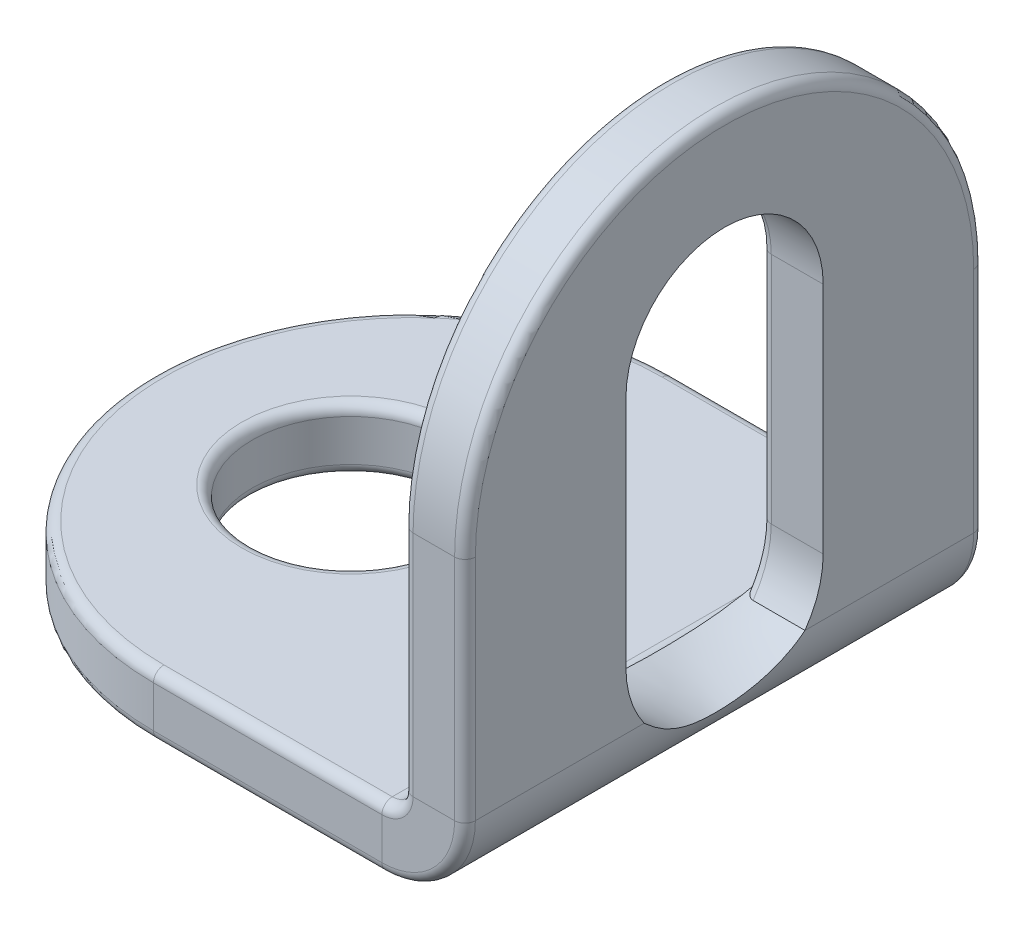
SolidWorks part; units mm, degrees
ref_plane "Front" through (0, 0, 0) normal (0, 0, 1) x (1, 0, 0)
ref_plane "Top" through (0, 0, 0) normal (0, 1, 0) x (1, 0, 0)
ref_plane "Right" through (0, 0, 0) normal (1, 0, 0) x (0, 0, -1)
sketch "Sketch1" plane through (0, 0, 0) normal (0, 1, 0) x (1, 0, 0)
  line L1 (0, 0) -> (15.24, 0)
  line L2 (11.049, 8.763) -> (16.764, 8.763)
  line L3 (0, 12.7) -> (15.24, 12.7)
  line L5 (11.049, 3.937) -> (16.764, 3.937)
  arc A0 (0, 12.7) -> (0, 0) centre (0, 6.35) ccw
  arc A1 (15.24, 0) -> (15.24, 12.7) centre (15.24, 6.35) ccw
  circle A2 centre (-1.524, 6.35) radius 2.413
  arc A3 (11.049, 8.763) -> (11.049, 3.937) centre (11.049, 6.35) ccw
  arc A4 (16.764, 3.937) -> (16.764, 8.763) centre (16.764, 6.35) ccw
  dimension "D3" = 4.826
  dimension "D1" = 12.7
  dimension "D2" = 15.24
  dimension "D4" = 1.524
  dimension "D5" = 4.826
  dimension "D6" = 2.413
  dimension "D7" = 1.524
  dimension "D8" = 5.715
sheet metal parameters "Sheet-Metal1" thickness 1.524 parameters "D1"=3.81
base flange "Base-Flange1" sketch "Sketch1" thickness 1.524 reverse thickness direction yes parameters "D1"=3.81
sketch "Sketch3" plane through (0, 1.524, 0) normal (0, 1, 0) x (-1, 0, 0)
  line L0 (-7.62, -12.7) -> (-7.62, 0) construction
  line L1 (-15.24, -12.7) -> (0, -12.7) construction
  line L2 (0, 0) -> (-15.24, 0) construction
  line L3 (-7.62, -12.7) -> (-7.62, 0)
sketched bend "Sketched Bend1" parameters "D1"=0.508
bend "SketchBend1" bend radius 0.508 bend angle 90 parameters "D5"=1
fillet "Fillet1" radius 0.254 26 edges at (6.096, 13.97, -6.35) (6.096, 4.826, -12.7) (6.096, 6.2865, -3.937) (6.096, 11.557, -6.35) (6.096, 6.2865, -8.763) (6.096, 4.826, 0) (7.62, 4.826, 0) (7.62, 4.826, -12.7) (7.62, 13.97, -6.35) (-6.35, 0, -6.35) (-1.524, 1.524, -3.937) (2.794, 1.524, 0) (2.794, 1.524, -12.7) (-6.35, 1.524, -6.35) (2.794, 0, -12.7) (-1.524, 0, -3.937) (2.794, 0, 0) (7.0248, 0.5952, 0) (7.0248, 0.5952, -12.7) (5.9472, 1.6728, -12.7) (5.9472, 1.6728, 0)
flat pattern "Flat-Pattern1"
sketch "Bend-Lines1" plane through (0, 0, 0) normal (0, 1, 0) x (-1, 0, 0)
bend of the flat pattern "Flatten-<SketchBend1>1"
